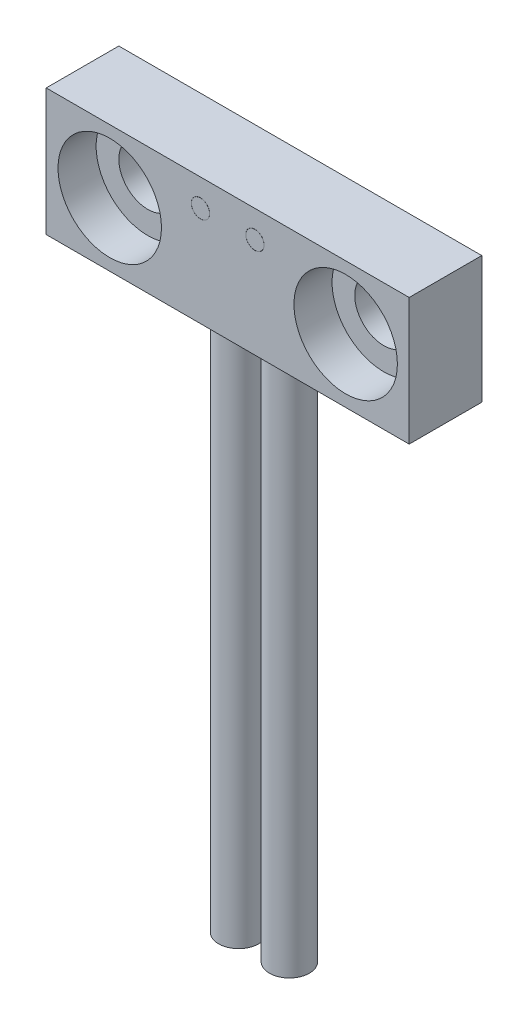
SolidWorks part; units mm, degrees
ref_plane "前视基准面" through (0, 0, 0) normal (0, 0, 1) x (1, 0, 0)
ref_plane "上视基准面" through (0, 0, 0) normal (0, 1, 0) x (1, 0, 0)
ref_plane "右视基准面" through (0, 0, 0) normal (1, 0, 0) x (0, 0, -1)
sketch "草图1" plane through (0, 0, 0) normal (0, 0, 1) x (1, 0, 0)
  line L1 (10, -3.5) -> (-10, -3.5)
  line L2 (10, -3.5) -> (10, 3.5)
  line L3 (10, 3.5) -> (-10, 3.5)
  line L4 (-10, -3.5) -> (-10, 3.5)
  line L5 (10, -3.5) -> (-10, 3.5) construction
  line L6 (10, 3.5) -> (-10, -3.5) construction
  point P0 (0, 0)
  dimension "D1" = 7
  dimension "D2" = 20
extrude "凸台-拉伸1" add sketch "草图1" along normal mid plane 4
hole_wizard "沉头孔1" positions "草图6" profile "草图7" counterbore size "M2" standard "GB"
sketch "草图6" plane through (0, 0, 2) normal (0, 0, 1) x (1, 0, 0)
  line L1 (10, 3.5) -> (-10, 3.5) construction
  point P0 (-6.5, 0)
  point P2 (6.5, 0)
  point P20 (0, 0)
  dimension "D1" = 13
  dimension "D2" = 6.5
  dimension "D3" = 3.5
sketch "草图7" plane through (-6.5, 0, 2) normal (1, 0, 0) x (0, -1, 0)
  line L0 (0, 0) -> (0, 4)
  line L1 (0, 4) -> (1.6, 4)
  line L3 (1.6, 4) -> (1.6, 2.1)
  line L4 (1.6, 2.1) -> (2.85, 2.1)
  line L5 (2.85, 2.1) -> (2.85, 0)
  line L7 (2.85, 0) -> (0, 0)
  line L11 (0, -6.35) -> (0, 107.95) construction
  dimension "通孔孔直径" = 3.2
  dimension "通孔孔深度" = 4
  dimension "柱形沉头孔直径" = 5.7
  dimension "柱形沉头孔深度" = 2.1
sketch "草图8" plane through (0, 0, 2) normal (0, 0, 1) x (1, 0, 0)
  line L0 (0, -1000) -> (0, 49000) construction
  line L1 (10, 3.5) -> (-10, 3.5) construction
  circle A0 centre (-1.5, 2) radius 0.5
  circle A1 centre (1.5, 2) radius 0.5
  circle A2 centre (-1.5, 2) radius 0.505
  circle A3 centre (1.5, 2) radius 0.505
  dimension "D1" = 1
  dimension "D4" = 1.01
  dimension "D5" = 1.01
  dimension "D2" = 3
  dimension "D3" = 1.5
sketch "草图9" plane through (0, -3.5, 0) normal (0, -1, 0) x (1, 0, 0)
  circle A2 centre (1.4, 0) radius 1.1
  circle A3 centre (-1.4, 0) radius 1.1
  point P4 (0, 0)
  dimension "D1" = 2.2
  dimension "D2" = 0.3
  dimension "D3" = 0.3
extrude "凸台-拉伸2" add sketch "草图9" along normal blind 30
extrude "切除-拉伸1" cut sketch "草图8" against normal blind 0.1
